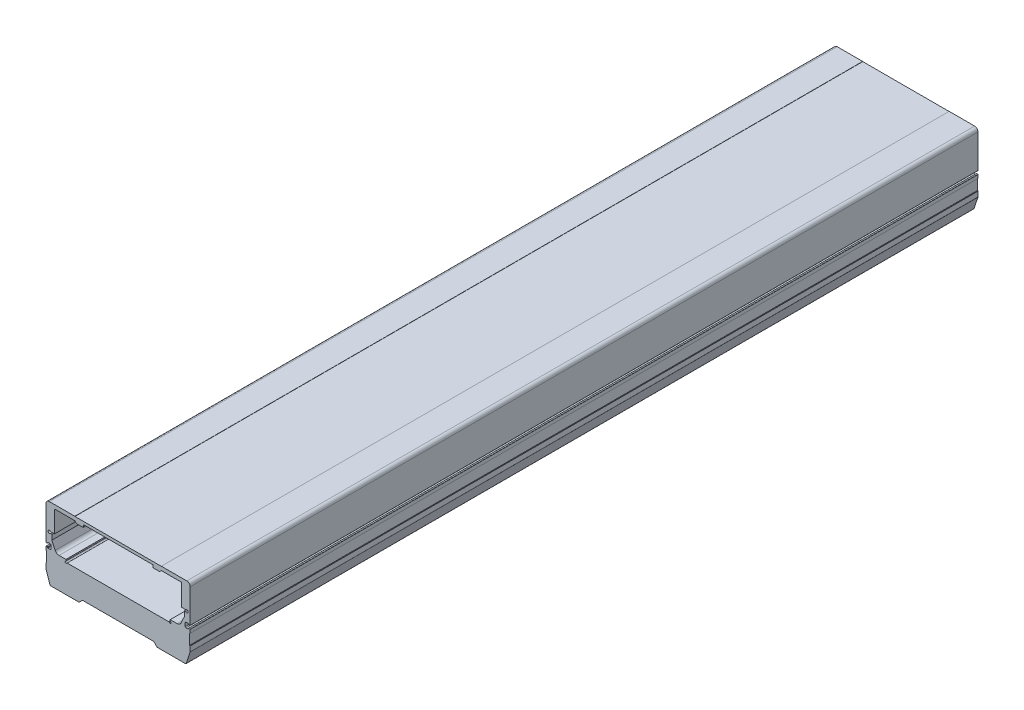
SolidWorks part; units mm, degrees
ref_plane "前视基准面" through (0, 0, 0) normal (0, 0, 1) x (1, 0, 0)
ref_plane "上视基准面" through (0, 0, 0) normal (0, 1, 0) x (1, 0, 0)
ref_plane "右视基准面" through (0, 0, 0) normal (1, 0, 0) x (0, 0, -1)
sketch "草图1" plane through (0, 0, 0) normal (0, 0, 1) x (1, 0, 0)
  line B0 (49, 74.8) -> (41.3, 74.8)
  line B1 (51, 76.8) -> (49, 74.8)
  line B2 (74, 76.8) -> (51, 76.8)
  line B3 (75, 51.3) -> (75, 75.8)
  line B4 (79.6876, 51.3) -> (75, 51.3)
  line B5 (78.1, 49.3) -> (79.6876, 49.3)
  line B6 (78.1, 43.3) -> (78.1, 49.3)
  line B7 (74.1769, 34.8869) -> (78.1, 43.3)
  line B8 (61.5, 32) -> (69.6454, 32)
  line B9 (61.5, 30.4142) -> (61.5, 32)
  line B10 (62.2071, 29.7071) -> (61.5, 30.4142)
  line B11 (60.0858, 29) -> (60.7929, 28.2929)
  line B12 (-60.0858, 29) -> (60.0858, 29)
  line B13 (-60.7929, 28.2929) -> (-60.0858, 29)
  line B14 (-61.5, 30.4142) -> (-62.2071, 29.7071)
  line B15 (-61.5, 32) -> (-61.5, 30.4142)
  line B16 (-69.6454, 32) -> (-61.5, 32)
  line B17 (-78.1, 43.3) -> (-74.1769, 34.8869)
  line B18 (-78.1, 49.3) -> (-78.1, 43.3)
  line B19 (-79.6876, 49.3) -> (-78.1, 49.3)
  line B20 (-75, 51.3) -> (-79.6876, 51.3)
  line B21 (-75, 75.8) -> (-75, 51.3)
  line B22 (-51, 76.8) -> (-74, 76.8)
  line B23 (-49, 74.8) -> (-51, 76.8)
  line B24 (-41.3, 74.8) -> (-49, 74.8)
  line B25 (-41, 77.8) -> (-41, 75.1)
  line B26 (41, 77.8) -> (-41, 77.8)
  line B27 (41, 75.1) -> (41, 77.8)
  line B28 (81, 81.3) -> (51, 81.3)
  line B29 (51, 81.3) -> (50.869, 81.169)
  line B30 (50.869, 81.169) -> (-50.869, 81.169)
  line B31 (-50.869, 81.169) -> (-51, 81.3)
  line B32 (-51, 81.3) -> (-81, 81.3)
  line B33 (-85, 77.3) -> (-85, 37.9)
  line B34 (-84.7, 37.6) -> (-83.3, 37.6)
  line B35 (-83, 37.9) -> (-83, 38.4)
  line B36 (-82.7, 38.7) -> (-80.2, 38.7)
  line B37 (-79.2, 37.7) -> (-79.2, 33.9)
  line B38 (-80.2, 32.9) -> (-82.7, 32.9)
  line B39 (-83, 33.2) -> (-83, 33.7)
  line B40 (-83.3, 34) -> (-84.7, 34)
  line B41 (-85, 33.7) -> (-85, 29.8)
  line B42 (-85, 29.8) -> (-84.5, 29.3)
  line B43 (-84.5, 29.3) -> (-84.5, 17.3)
  line B44 (-84.5, 17.3) -> (-85, 16.8)
  line B45 (-85, 16.8) -> (-85, 10.8623)
  line B46 (-84.9487, 10.546) -> (-80.3279, -3.3162)
  line B47 (-79.3792, -4) -> (-46, -4)
  line B48 (-46, -4) -> (-42, 0)
  line B49 (-42, 0) -> (42, 0)
  line B50 (42, 0) -> (46, -4)
  line B51 (46, -4) -> (79.3792, -4)
  line B52 (80.3279, -3.3162) -> (84.9487, 10.546)
  line B53 (85, 10.8623) -> (85, 16.8)
  line B54 (85, 16.8) -> (84.5, 17.3)
  line B55 (84.5, 17.3) -> (84.5, 29.3)
  line B56 (84.5, 29.3) -> (85, 29.8)
  line B57 (85, 29.8) -> (85, 33.7)
  line B58 (84.7, 34) -> (83.3, 34)
  line B59 (83, 33.7) -> (83, 33.2)
  line B60 (82.7, 32.9) -> (80.2, 32.9)
  line B61 (79.2, 33.9) -> (79.2, 37.7)
  line B62 (80.2, 38.7) -> (82.7, 38.7)
  line B63 (83, 38.4) -> (83, 37.9)
  line B64 (83.3, 37.6) -> (84.7, 37.6)
  line B65 (85, 37.9) -> (85, 77.3)
  arc B66 (75, 75.8) -> (74, 76.8) centre (74, 75.8) ccw
  arc B67 (79.6876, 49.3) -> (79.6876, 51.3) centre (81, 50.3) ccw
  arc B68 (69.6454, 32) -> (74.1769, 34.8869) centre (69.6454, 37) ccw
  arc B69 (60.7929, 28.2929) -> (62.2071, 29.7071) centre (61.5, 29) ccw
  arc B70 (-62.2071, 29.7071) -> (-60.7929, 28.2929) centre (-61.5, 29) ccw
  arc B71 (-74.1769, 34.8869) -> (-69.6454, 32) centre (-69.6454, 37) ccw
  arc B72 (-79.6876, 51.3) -> (-79.6876, 49.3) centre (-81, 50.3) ccw
  arc B73 (-74, 76.8) -> (-75, 75.8) centre (-74, 75.8) ccw
  arc B74 (-41.3, 74.8) -> (-41, 75.1) centre (-41.3, 75.1) ccw
  arc B75 (41, 75.1) -> (41.3, 74.8) centre (41.3, 75.1) ccw
  arc B76 (-81, 81.3) -> (-85, 77.3) centre (-81, 77.3) ccw
  arc B77 (-85, 37.9) -> (-84.7, 37.6) centre (-84.7, 37.9) ccw
  arc B78 (-83.3, 37.6) -> (-83, 37.9) centre (-83.3, 37.9) ccw
  arc B79 (-82.7, 38.7) -> (-83, 38.4) centre (-82.7, 38.4) ccw
  arc B80 (-79.2, 37.7) -> (-80.2, 38.7) centre (-80.2, 37.7) ccw
  arc B81 (-80.2, 32.9) -> (-79.2, 33.9) centre (-80.2, 33.9) ccw
  arc B82 (-83, 33.2) -> (-82.7, 32.9) centre (-82.7, 33.2) ccw
  arc B83 (-83, 33.7) -> (-83.3, 34) centre (-83.3, 33.7) ccw
  arc B84 (-84.7, 34) -> (-85, 33.7) centre (-84.7, 33.7) ccw
  arc B85 (-85, 10.8623) -> (-84.9487, 10.546) centre (-84, 10.8623) ccw
  arc B86 (-80.3279, -3.3162) -> (-79.3792, -4) centre (-79.3792, -3) ccw
  arc B87 (79.3792, -4) -> (80.3279, -3.3162) centre (79.3792, -3) ccw
  arc B88 (84.9487, 10.546) -> (85, 10.8623) centre (84, 10.8623) ccw
  arc B89 (85, 33.7) -> (84.7, 34) centre (84.7, 33.7) ccw
  arc B90 (83.3, 34) -> (83, 33.7) centre (83.3, 33.7) ccw
  arc B91 (82.7, 32.9) -> (83, 33.2) centre (82.7, 33.2) ccw
  arc B92 (79.2, 33.9) -> (80.2, 32.9) centre (80.2, 33.9) ccw
  arc B93 (80.2, 38.7) -> (79.2, 37.7) centre (80.2, 37.7) ccw
  arc B94 (83, 38.4) -> (82.7, 38.7) centre (82.7, 38.4) ccw
  arc B95 (83, 37.9) -> (83.3, 37.6) centre (83.3, 37.9) ccw
  arc B96 (84.7, 37.6) -> (85, 37.9) centre (84.7, 37.9) ccw
  arc B97 (85, 77.3) -> (81, 81.3) centre (81, 77.3) ccw
sketch_block_instance "块2-1"
sketch_block "块2"
extrude "凸台-拉伸1" add sketch "草图1" against normal blind 929
hole_wizard " 螺纹孔M8" positions "草图5" profile "草图6" tap size "M8" standard "GB"
sketch "草图5" plane through (0, -4, 0) normal (0, -1, 0) x (-1, 0, 0)
  line L6 (0, 929) -> (0, 1237.2993) construction
  line L8 (79.3792, 929) -> (46, 929) construction
  line L9 (42, 929) -> (-42, 929) construction
  point P0 (70, 870.5)
  point P2 (-70, 870.5)
  point P12 (70, 670.5)
  point P14 (-70, 670.5)
  point P19 (-70, 470.5)
  point P21 (70, 470.5)
  point P23 (-70, 270.5)
  point P25 (70, 270.5)
  point P27 (-70, 70.5)
  point P29 (70, 70.5)
  point P31 (-70, -129.5)
  point P33 (70, -129.5)
  point P36 (70, -329.5)
  point P38 (-70, -329.5)
  point P53 (-70, -529.5)
  point P57 (70, -529.5)
  dimension "D1" = 58.5
  dimension "D2" = 200
  dimension "D3" = 200
  dimension "D4" = 200
  dimension "D5" = 200
  dimension "D6" = 200
  dimension "D7" = 200
  dimension "D8" = 140
  dimension "D9" = 200
sketch "草图6" plane through (-70, -4, -870.5) normal (1, 0, 0) x (0, 0, -1)
  line L0 (0, 0) -> (0, 21.7929)
  line L1 (0, 21.7929) -> (3.4, 19.75)
  line L2 (3.4, 19.75) -> (3.4, 0)
  line L5 (3.4, 0) -> (0, 0)
  line L10 (0, 21.7929) -> (-3.4, 19.75) construction
  line L11 (0, -6.35) -> (0, 107.95) construction
  dimension "螺纹孔钻头直径" = 6.8
  dimension "螺纹孔钻头深度" = 19.75
  dimension "导头角度" = 118
